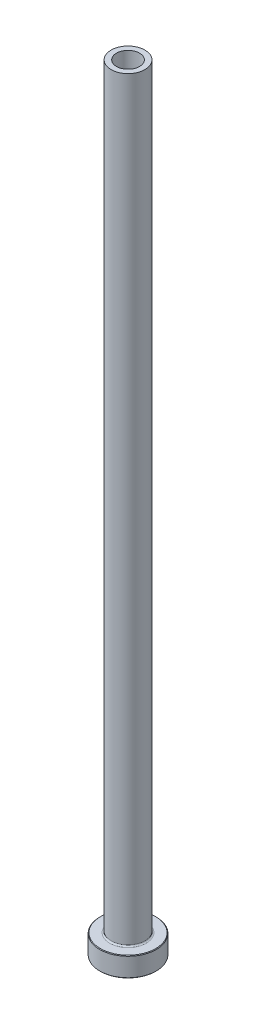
SolidWorks part; units mm, degrees
ref_plane "Front Plane" through (0, 0, 0) normal (0, 0, 1) x (1, 0, 0)
ref_plane "Top Plane" through (0, 0, 0) normal (0, 1, 0) x (1, 0, 0)
ref_plane "Right Plane" through (0, 0, 0) normal (1, 0, 0) x (0, 0, -1)
sketch "Sketch1" plane through (0, 0, 0) normal (0, 0, 1) x (1, 0, 0)
  line L0 (-4.1, 275) -> (-6, 275)
  line L1 (-6, 275) -> (-6, 7)
  line L2 (-6, 7) -> (-10, 7)
  line L3 (-10, 7) -> (-10, 0)
  line L4 (11, 0) -> (-11, 0) construction
  line L5 (-10, 0) -> (-4.35, 0)
  line L6 (-4.1, 230) -> (-4.1, 275)
  line L7 (0, 92.1877) -> (0, -15.5353) construction
  line L8 (0, -11) -> (0, 11) construction
  line L9 (-4.1, 230) -> (-4.35, 218)
  line L10 (-4.35, 218) -> (-4.35, 0)
  dimension "D1" = 0.25
  dimension "ID" = 8.2
  dimension "OD" = 12
  dimension "L" = 275
  dimension "H" = 20
  dimension "T" = 7
  dimension "N" = 45
  dimension "D2" = 12
revolve "Revolve1" add sketch "Sketch1" angle 360 about L7
fillet "Fillet1" radius 0.5 1 edges at (0, 7, 6)
chamfer "Chamfer1" distance 0.2 angle 45 2 edges at (0, 7, 10) (0, 0, 10)
chamfer "Chamfer3" distance 0.5 angle 45 1 edges at (0, 0, 4.35)
